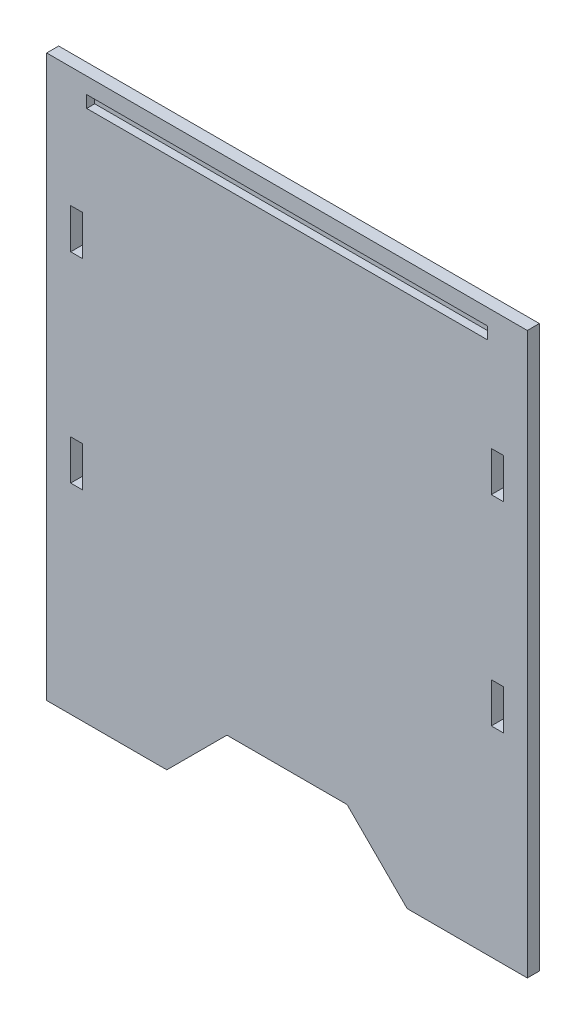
SolidWorks part; units mm, degrees
ref_plane "Alzado" through (0, 0, 0) normal (0, 0, 1) x (1, 0, 0)
ref_plane "Planta" through (0, 0, 0) normal (0, 1, 0) x (1, 0, 0)
ref_plane "Vista lateral" through (0, 0, 0) normal (1, 0, 0) x (0, 0, -1)
sketch "Croquis1" plane through (0, 0, 0) normal (0, 0, 1) x (1, 0, 0)
  line L0 (-150, -350) -> (-75, -275)
  line L1 (-300, -350) -> (-150, -350)
  line L2 (-300, -350) -> (-300, 350)
  line L3 (-300, 350) -> (300, 350)
  line L4 (300, -350) -> (300, 350)
  line L5 (-300, -350) -> (300, 350) construction
  line L6 (-300, 350) -> (300, -350) construction
  line L7 (-75, -275) -> (75, -275)
  line L8 (75, -275) -> (150, -350)
  line L9 (150, -350) -> (300, -350)
  point P0 (0, 0)
  dimension "D1" = 700
  dimension "D2" = 600
  dimension "D3" = 150
  dimension "D4" = 150
  dimension "D5" = 225
  dimension "D6" = 225
  dimension "D7" = 150
extrude "Saliente-Extruir1" add sketch "Croquis1" along normal blind 15
sketch "Croquis2" plane through (0, 0, 15) normal (0, 0, 1) x (1, 0, 0)
  line L0 (300, 350) -> (-300, 350) construction
  line L1 (-250, 315) -> (250, 315)
  line L2 (-250, 315) -> (-250, 330)
  line L3 (-250, 330) -> (250, 330)
  line L4 (250, 315) -> (250, 330)
  line L5 (-250, 315) -> (250, 330) construction
  line L6 (-250, 330) -> (250, 315) construction
  line L7 (300, -350) -> (300, 350) construction
  point P0 (0, 322.5)
  dimension "D1" = 20
  dimension "D2" = 500
  dimension "D3" = 15
  dimension "D4" = 50
extrude "Cortar-Extruir1" cut sketch "Croquis2" against normal blind 10
sketch "Croquis4" plane through (0, 0, 15) normal (0, 0, 1) x (1, 0, 0)
  line L0 (300, -350) -> (300, 350) construction
  line L1 (255, 150) -> (270, 150)
  line L2 (255, 150) -> (255, 200)
  line L3 (255, 200) -> (270, 200)
  line L4 (270, 150) -> (270, 200)
  line L5 (255, 150) -> (270, 200) construction
  line L6 (255, 200) -> (270, 150) construction
  line L7 (255, -100) -> (270, -100)
  line L8 (255, -100) -> (255, -50)
  line L9 (255, -50) -> (270, -50)
  line L10 (270, -100) -> (270, -50)
  line L11 (255, -100) -> (270, -50) construction
  line L12 (255, -50) -> (270, -100) construction
  line L13 (300, 350) -> (-300, 350) construction
  line L15 (-255.5, 150) -> (-270, 150)
  line L16 (-255.5, 150) -> (-255.5, 200)
  line L17 (-255.5, 200) -> (-270, 200)
  line L18 (-270, 150) -> (-270, 200)
  line L19 (-255.5, 150) -> (-270, 200) construction
  line L20 (-255.5, 200) -> (-270, 150) construction
  line L21 (-255.5, -100) -> (-270, -100)
  line L22 (-255.5, -100) -> (-255.5, -50)
  line L23 (-255.5, -50) -> (-270, -50)
  line L24 (-270, -100) -> (-270, -50)
  line L25 (-255.5, -100) -> (-270, -50) construction
  line L26 (-255.5, -50) -> (-270, -100) construction
  line L27 (-300, 350) -> (-300, -350) construction
  point P0 (262.5, 175)
  point P5 (262.5, -75)
  point P14 (-262.75, 175)
  point P19 (-262.75, -75)
  point P24 (0, 0)
  dimension "D1" = 15
  dimension "D2" = 50
  dimension "D3" = 30
  dimension "D4" = 150
  dimension "D5" = 15
  dimension "D6" = 50
  dimension "D7" = 30
  dimension "D8" = 200
  dimension "D9" = 50
  dimension "D10" = 50
  dimension "D11" = 14.5
  dimension "D12" = 14.5
  dimension "D13" = 150
  dimension "D14" = 30
  dimension "D15" = 200
  dimension "D16" = 30
extrude "Cortar-Extruir2" cut sketch "Croquis4" against normal blind 15
